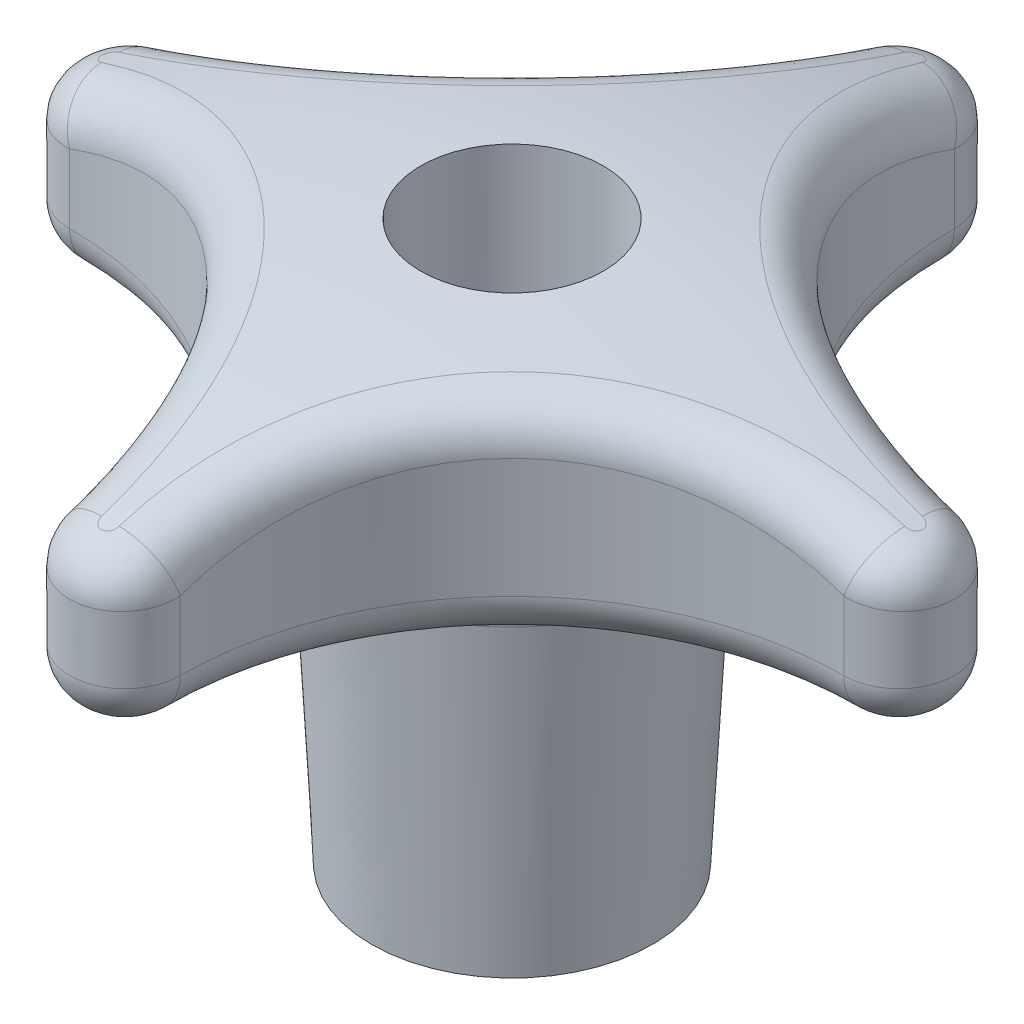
SolidWorks part; units mm, degrees
ref_plane "Front Plane" through (0, 0, 0) normal (0, 0, 1) x (1, 0, 0)
ref_plane "Top Plane" through (0, 0, 0) normal (0, 1, 0) x (1, 0, 0)
ref_plane "Right Plane" through (0, 0, 0) normal (1, 0, 0) x (0, 0, -1)
sketch "Sketch1" plane through (0, 0, 0) normal (0, 1, 0) x (1, 0, 0)
  circle A0 centre (0, 0) radius 10
  dimension "D1" = 20
extrude "Extrude1" add sketch "Sketch1" against normal blind 24
draft "Draft1" type of draft neutral plane draft angle 3 faces to draft 1 parameters "D1"=3
sketch "Sketch2" plane through (0, 0, 0) normal (0, 0, 1) x (1, 0, 0)
  line L0 (0, 0) -> (-31.5, 0)
  line L1 (-31.5, 0) -> (-31.5, 10.4)
  line L2 (0, 0) -> (0, 50000) construction
  line L3 (0, 16) -> (20.2547, 16) construction
  line L4 (0, 0) -> (0, 16)
  arc A0 (0, 16) -> (-31.5, 10.4) centre (0, -75.3937) ccw
revolve "Revolve1" add sketch "Sketch2" angle 360 about L2
sketch "Sketch4" plane through (0, 0, 0) normal (0, 1, 0) x (1, 0, 0)
  line L0 (0, 0) -> (-50000, 0) construction
  line L1 (0, 0) -> (0, 50000) construction
  line L2 (-27.5625, 3.9375) -> (-45.9117, 3.9375) construction
  line L3 (-3.9375, 27.5625) -> (-3.9375, 40.3224) construction
  arc A0 (0, 31.5) -> (-3.9375, 27.5625) centre (0, 27.5625) ccw
  arc A1 (-27.5625, 3.9375) -> (-31.5, 0) centre (-27.5625, 0) ccw
  circle A2 centre (0, 0) radius 31.5 construction
  arc A3 (-27.5625, 3.9375) -> (-3.9375, 27.5625) centre (-27.5625, 27.5625) ccw
  arc A4 (0, 31.5) -> (-31.5, 0) centre (-31.5, 31.5) ccw
  point P9 (0, 31.5)
  point P10 (-31.5, 0)
  point P13 (-3.9375, 27.5625)
  point P14 (-27.5625, 3.9375)
extrude "Extrude3" cut sketch "Sketch4" along normal through all
pattern_circular "CirPattern1" count 4 over 360 about axis through (0, 0, 0) along (0, 1, 0) of "Extrude3"
fillet "Fillet2" radius 3.3333 16 edges at (0, 0, 31.5) (10.8571, 0, 10.8571) (31.5, 0, 0) (10.8571, 0, -10.8571) (0, 0, -31.5) (-10.8571, 0, -10.8571) (-31.5, 0, 0) (-0.0002, 10.4, 31.5) (13.2545, 14.6082, 8.763) (31.5, 10.4, 0.0002) (8.763, 14.6082, -13.2545) (0.0002, 10.4, -31.5) (-13.2545, 14.6082, -8.763) (-31.5, 10.4, 0.0002) (-10.8571, 0, 10.8571) (-8.763, 14.6082, 13.2545)
fillet "Fillet3" radius 1.6667 1 edges at (0, 0, 11.2578)
sketch "Sketch6" [suppressed] plane through (0, -25, 0) normal (0, -1, 0) x (1, 0, 0)
  circle A0 centre (0, 0) radius 3
  dimension "D1" = 8
extrude "Extrude5" [suppressed] cut sketch "Sketch6" against normal blind 18
sketch "Sketch7" [suppressed] plane through (0, 0, 0) normal (0, 0, 1) x (1, 0, 0)
  line L0 (0, -10) -> (3, -10)
  line L1 (3, -25) -> (3, -10) construction
  line L2 (3, -10) -> (0, -8.2679)
  line L3 (0, -8.2679) -> (0, -10)
  line L4 (-3, -25) -> (3, -25) construction
revolve "Cut-Revolve1" [suppressed] cut sketch "Sketch7" angle 360 about L3
sketch "Sketch8" plane through (0, -24, 0) normal (0, -1, 0) x (1, 0, 0)
  circle A0 centre (0, 0) radius 6
  dimension "D1" = 12
extrude "Extrude6" cut sketch "Sketch8" against normal blind 20
sketch "Sketch9" plane through (0, -4, 0) normal (0, -1, 0) x (1, 0, 0)
  circle A0 centre (0, 0) radius 6.5
  dimension "D1" = 13
extrude "Extrude7" cut sketch "Sketch9" against normal through all
sketch "Sketch10" [suppressed] plane through (0, -25, 0) normal (0, -1, 0) x (1, 0, 0)
  circle A0 centre (0, 0) radius 6
extrude "Extrude8" [suppressed] cut sketch "Sketch10" against normal blind 15
sketch "Sketch11" [suppressed] plane through (0, 0, 0) normal (0, 0, 1) x (1, 0, 0)
  line L0 (5.1, 6.0555) -> (5.1, -3)
  line L1 (0, 0) -> (0, -5.4531) construction
  line L2 (5.1, 6.0555) -> (0, 9)
  line L3 (0, 9) -> (0, -3)
  line L4 (-6, -3) -> (6, -3) construction
  line L5 (5.1, -3) -> (0, -3)
revolve "Cut-Revolve2" [suppressed] cut sketch "Sketch11" angle 360 about L3
equation "\"D2@Sketch2\" = \"D1@Sketch2\"*.65"
equation "\"D1@Sketch4\" = (\"D3@Sketch2\"*2)/8"
equation "\"D2@Sketch4\" =( \"D3@Sketch2\"*2)/8"
equation "\"D1@Sketch7\" = \"D1@Extrude5\""
equation "\"D1@Fillet3\" = \"D1@Fillet2\"/2"
equation "\"D2@Sketch11\" = \"D1@Sketch10\""
